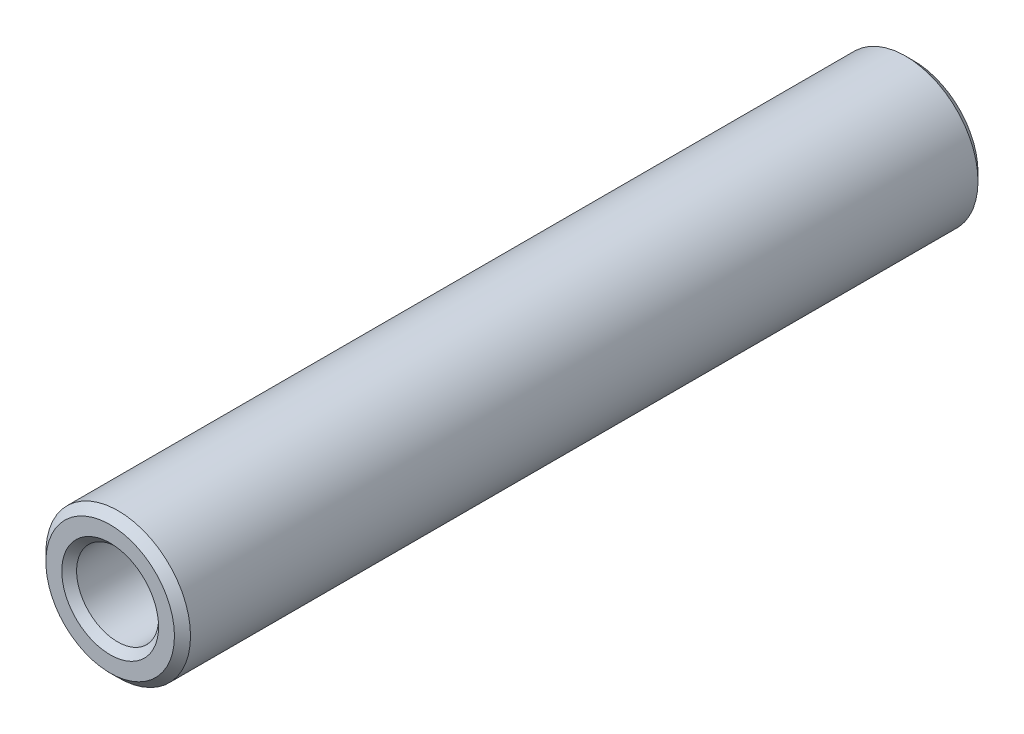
SolidWorks part; units mm, degrees
ref_plane "Plan de face" through (0, 0, 0) normal (0, 0, 1) x (1, 0, 0)
ref_plane "Plan de dessus" through (0, 0, 0) normal (0, 1, 0) x (1, 0, 0)
ref_plane "Plan de droite" through (0, 0, 0) normal (1, 0, 0) x (0, 0, -1)
sketch "Esquisse1" plane through (0, 0, 0) normal (0, 0, 1) x (1, 0, 0)
  circle A0 centre (0, 0) radius 9
  dimension "D1" = 18
extrude "Boss.-Extru.1" add sketch "Esquisse1" along normal blind 100
chamfer "Chanfrein1" distance 1 angle 45 2 edges at (9, 0, 0) (9, 0, 100)
sketch "Position taraudage M12" plane through (0, 0, 100) normal (0, 0, 1) x (1, 0, 0)
  point P0 (0, 0)
hole_wizard "Taraudage M12 pou extraction" positions "Esquisse3D4" profile "Esquisse6" tap size "M12" standard "DIN"
sketch3d "Esquisse3D4"
  point P0 (0, 0, 100)
sketch "Esquisse6" plane through (0, 0, 100) normal (1, 0, 0) x (0, -1, 0)
  line L0 (0, 0) -> (0, 31.8144)
  line L1 (0, 31.8144) -> (5.1, 28.75)
  line L2 (5.1, 28.75) -> (5.1, 0.925)
  line L3 (5.1, 0.925) -> (6.025, 0)
  line L5 (6.025, 0) -> (0, 0)
  line L6 (-5.1, 0.925) -> (-6.025, 0) construction
  line L10 (0, 31.8144) -> (-5.1, 28.75) construction
  line L11 (0, -6.35) -> (0, 107.95) construction
  dimension "Diamètre du trou pour taraudage" = 10.2
  dimension "Profondeur du trou pour taraudage" = 28.75
  dimension "Diamètre du fraisage entrant" = 12.05
  dimension "Angle du fraisage entrant" = 90
  dimension "Angle de pointe" = 118
